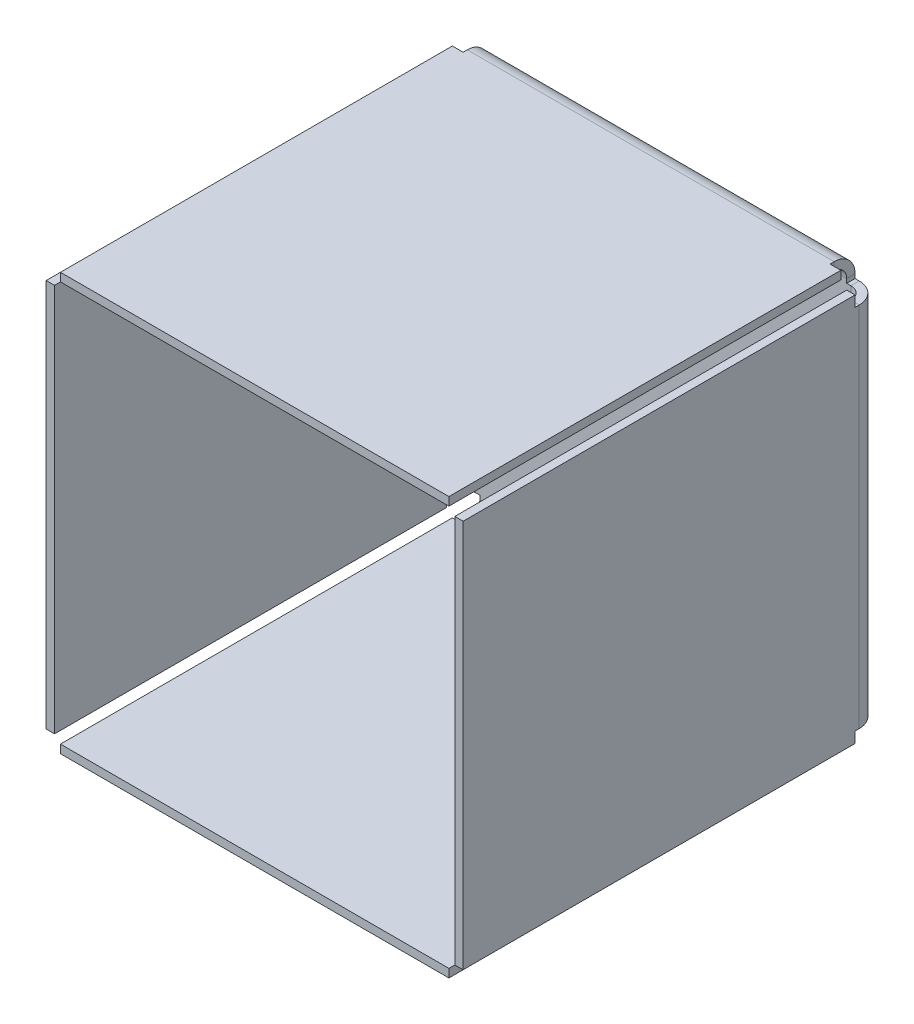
SolidWorks part; units mm, degrees
ref_plane "Ebene vorne" through (0, 0, 0) normal (0, 0, 1) x (1, 0, 0)
ref_plane "Ebene oben" through (0, 0, 0) normal (0, 1, 0) x (1, 0, 0)
ref_plane "Ebene rechts" through (0, 0, 0) normal (1, 0, 0) x (0, 0, -1)
sketch "Skizze1" plane through (0, 0, 0) normal (0, 0, 1) x (1, 0, 0)
  line L1 (-25, -25) -> (25, -25)
  line L2 (-25, -25) -> (-25, 25)
  line L3 (-25, 25) -> (25, 25)
  line L4 (25, -25) -> (25, 25)
  line L5 (-25, -25) -> (25, 25) construction
  line L6 (-25, 25) -> (25, -25) construction
  point P0 (0, 0)
  dimension "D1" = 50
  dimension "D2" = 50
extrude "Linear austragen1" add sketch "Skizze1" along normal blind 50
shell "Wandung1" thickness 1
rip "Schlitz2"
sheet metal parameters "Blech2" parameters "D1"=1.5, "Dicke"=1
bend "Biegung-Winkel8" bend angle 90 parameters "D1"=0, "D5"=1
flatten bends "Abwickeln2" parameters "D1"=0
sketch "Skizze-Winkel2" plane through (0, 0, 0) normal (0, 0, -1) x (-1, 0, 0)
  line L0 (22, -24.0708) -> (-22, -24.0708) construction
  line L1 (24.0708, 22) -> (24.0708, -22) construction
  line L2 (-22, 24.0708) -> (22, 24.0708) construction
  line L3 (-24.0708, -22) -> (-24.0708, 22) construction
bend "Biegung-Winkel5" bend angle 90 parameters "D1"=0, "D5"=4
bend "Biegung-Winkel6" bend angle 90 parameters "D1"=0, "D5"=3
bend "Biegung-Winkel7" bend angle 90 parameters "D1"=0, "D5"=2
process bends "Abbiegen2" parameters "D1"=0
sketch "Abwicklung-Skizze2" plane through (0, 0, 0) normal (0, 0, -1) x (-1, 0, 0)
flat pattern "Abwicklung2"
sketch "Biegung-Linien2" plane through (0, 0, 0) normal (0, 1, 0) x (-1, 0, 0)
bend of the flat pattern "Abwickeln-<Biegung-Winkel5>1"
bend of the flat pattern "Abwickeln-<Biegung-Winkel6>1"
bend of the flat pattern "Abwickeln-<Biegung-Winkel7>1"
bend of the flat pattern "Abwickeln-<Biegung-Winkel8>1"
